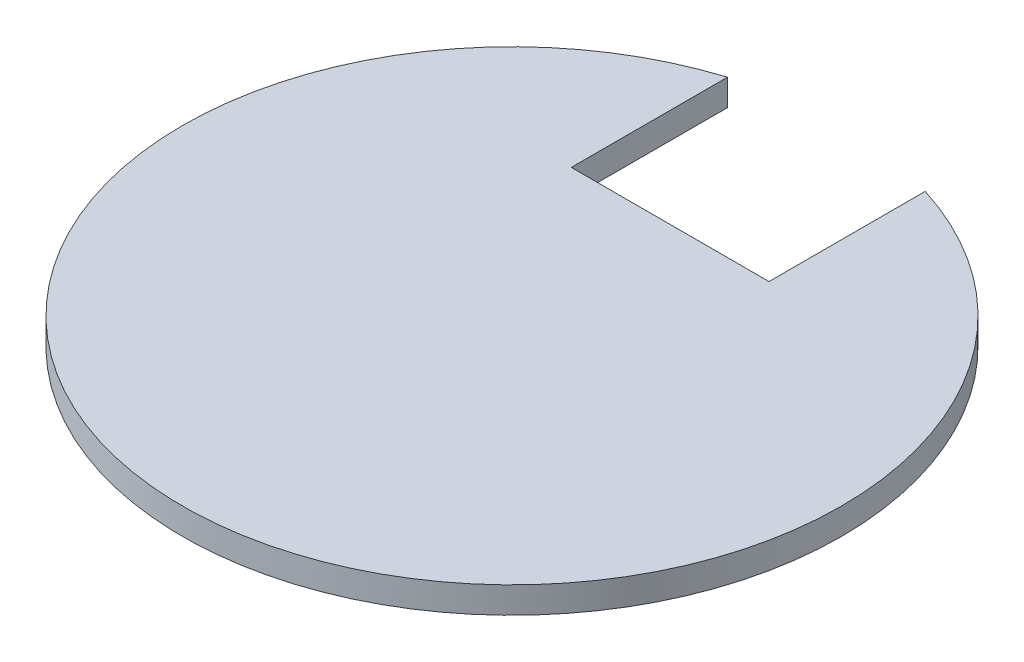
SolidWorks part; units mm, degrees
ref_plane "Płaszczyzna przednia" through (0, 0, 0) normal (0, 0, 1) x (1, 0, 0)
ref_plane "Płaszczyzna górna" through (0, 0, 0) normal (0, 1, 0) x (1, 0, 0)
ref_plane "Płaszczyzna prawa" through (0, 0, 0) normal (1, 0, 0) x (0, 0, -1)
sketch "Szkic1" plane through (0, 0, 0) normal (0, 1, 0) x (1, 0, 0)
  line L129 (22.5298, 3) -> (16.8, 3) construction
  line L130 (15.8, 2) -> (15.8, -8.9) construction
  line L131 (16.8, -9.9) -> (20.2899, -9.9) construction
  line L132 (-22.5298, -3) -> (-16.8, -3) construction
  line L136 (-15.8, -2) -> (-15.8, 12.2844) construction
  line L137 (-15.8, 12.2844) -> (19.5184, 12.2844) construction
  line L138 (22.5298, 3.2) -> (16.8, 3.2)
  line L139 (15.6, 2) -> (15.6, -8.9)
  line L140 (16.8, -10.1) -> (20.2899, -10.1)
  line L141 (-22.5298, -3.2) -> (-16.8, -3.2)
  line L142 (-15.6, -2) -> (-15.6, 11.5844)
  line L143 (-15.1, 12.0844) -> (19.5184, 12.0844)
  line L144 (-15.6, 12.0844) -> (19.5184, 12.0844) construction
  line L145 (-15.6, -2) -> (-15.6, 12.0844) construction
  arc A146 (19.9464, 12.0429) -> (19.5184, 12.2844) centre (19.5184, 11.7844) ccw construction
  arc A147 (23.0238, 3.5768) -> (19.9464, 12.0429) centre (0, 0) ccw construction
  arc A148 (22.5298, 3) -> (23.0238, 3.5768) centre (22.5298, 3.5) ccw construction
  arc A149 (16.8, 3) -> (15.8, 2) centre (16.8, 2) ccw construction
  arc A150 (15.8, -8.9) -> (16.8, -9.9) centre (16.8, -8.9) ccw construction
  arc A151 (20.7349, -10.6281) -> (20.2899, -9.9) centre (20.2899, -10.4) ccw construction
  arc A152 (-23.0238, -3.5768) -> (20.7349, -10.6281) centre (0, 0) ccw construction
  arc A153 (-22.5298, -3) -> (-23.0238, -3.5768) centre (-22.5298, -3.5) ccw construction
  arc A154 (-16.8, -3) -> (-15.8, -2) centre (-16.8, -2) ccw construction
  arc A160 (16.8, 3.2) -> (15.6, 2) centre (16.8, 2) ccw
  arc A161 (15.6, -8.9) -> (16.8, -10.1) centre (16.8, -8.9) ccw
  arc A162 (20.5569, -10.5368) -> (20.2899, -10.1) centre (20.2899, -10.4) ccw
  arc A163 (-22.8262, -3.5461) -> (20.5569, -10.5368) centre (0, 0) ccw
  arc A164 (-22.5298, -3.2) -> (-22.8262, -3.5461) centre (-22.5298, -3.5) ccw
  arc A165 (-16.8, -3.2) -> (-15.6, -2) centre (-16.8, -2) ccw
  arc A166 (19.7752, 11.9395) -> (19.5184, 12.0844) centre (19.5184, 11.7844) ccw
  arc A167 (22.8262, 3.5461) -> (19.7752, 11.9395) centre (0, 0) ccw
  arc A168 (22.5298, 3.2) -> (22.8262, 3.5461) centre (22.5298, 3.5) ccw
  arc A169 (-15.1, 12.0844) -> (-15.6, 11.5844) centre (-15.1, 11.5844) ccw
  dimension "D1" = 0.2
  dimension "D2" = 0.5
sketch "Szkic3" plane through (0, 0, 0) normal (0, -1, 0) x (-1, 0, 0)
  circle A0 centre (0, 0) radius 25
  dimension "D1" = 50
extrude "Dodanie-wyciągnięcie2" add sketch "Szkic3" against normal blind 2
sketch "Szkic4" plane through (0, -0.8, 0) normal (0, 1, 0) x (1, 0, 0)
  circle A0 centre (-9, 0) radius 1.25
  circle A1 centre (9, 0) radius 1.25
  circle A2 centre (9, 0) radius 2.75
  circle A3 centre (-9, 0) radius 2.75
  dimension "D1" = 9
  dimension "D3" = 2.5
  dimension "D4" = 2.5
  dimension "D2" = 9
sketch "Szkic5" plane through (0, 0, 0) normal (0, -1, 0) x (1, 0, 0)
  line L1 (-7.5, -42) -> (7.5, -42)
  line L2 (-7.5, -42) -> (-7.5, -12)
  line L3 (-7.5, -12) -> (7.5, -12)
  line L4 (7.5, -42) -> (7.5, -12)
  line L5 (0, -12) -> (0, -42) construction
  line L6 (-7.5, -27) -> (7.5, -27) construction
  point P0 (0, -26)
  dimension "D1" = 30
  dimension "D2" = 15
  dimension "D4" = 27
extrude "Wytnij-wyciągnięcie1" cut sketch "Szkic5" against normal through all both and the other way through all
chamfer "Sfazowanie7" distance 2.6 angle 45
fillet "Zaokrąglenie1" radius 0.5
